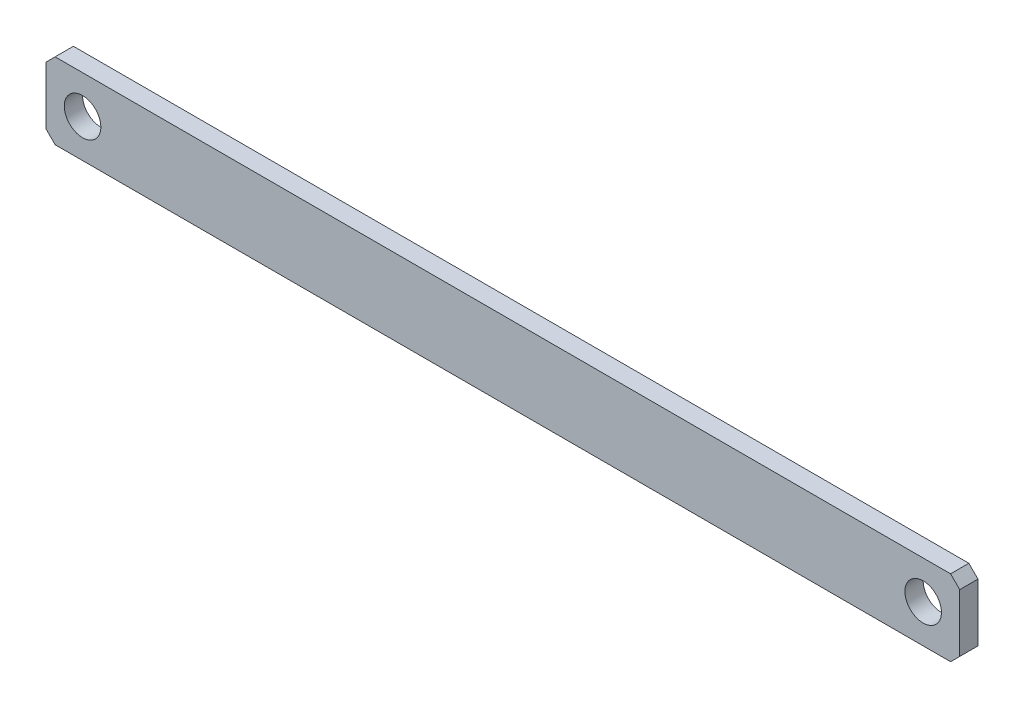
SolidWorks part; units mm, degrees
ref_plane "Front Plane" through (0, 0, 0) normal (0, 0, 1) x (1, 0, 0)
ref_plane "Top Plane" through (0, 0, 0) normal (0, 1, 0) x (1, 0, 0)
ref_plane "Right Plane" through (0, 0, 0) normal (1, 0, 0) x (0, 0, -1)
sketch "Sketch1" plane through (0, 0, 0) normal (0, 0, 1) x (1, 0, 0)
  line L1 (0, 1.6233) -> (76.2, 1.6233)
  line L2 (0, 1.6233) -> (0, 7.9733)
  line L3 (0, 7.9733) -> (76.2, 7.9733)
  line L4 (76.2, 1.6233) -> (76.2, 7.9733)
  dimension "D1" = 6.35
  dimension "D2" = 76.2
extrude "plate" add sketch "Sketch1" along normal blind 1.524
sketch "Sketch2" plane through (0, 0, 0) normal (0, 0, 1) x (1, 0, 0)
  line L0 (0, 4.7983) -> (76.2, 4.7983) construction
  line L1 (0, 7.9733) -> (0, 1.6233) construction
  line L2 (76.2, 1.6233) -> (76.2, 7.9733) construction
  circle A0 centre (3.048, 4.7983) radius 1.524
  circle A1 centre (73.152, 4.7983) radius 1.524
other "AlignGroup1" parameters "D1"=2.3038, "D2"=3.048, "D3"=73.152, "D4"=76.2
extrude "holes" cut sketch "Sketch2" along normal blind 1.524
chamfer "Chamfer1" distance 0.762 angle 45 4 edges at (76.2, 1.6233, 0.762) (76.2, 7.9733, 0.762) (0, 1.6233, 0.762) (0, 7.9733, 0.762)
